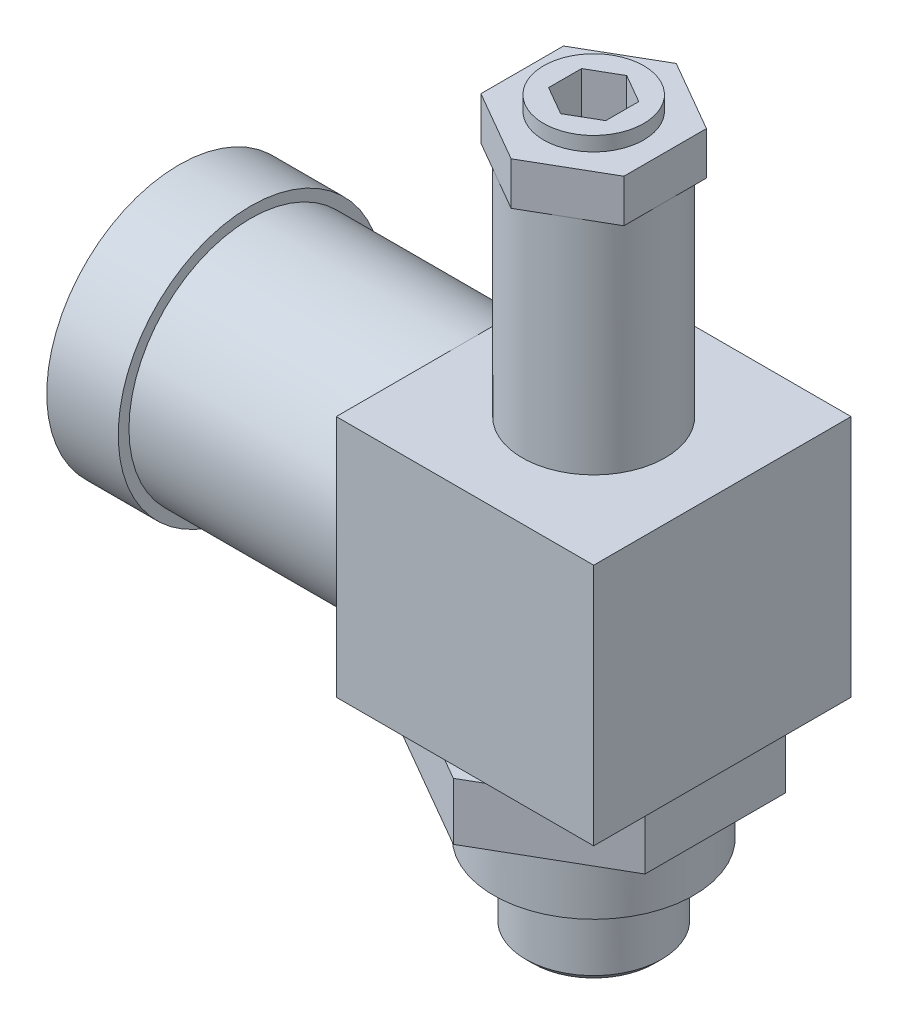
SolidWorks part; units mm, degrees
ref_plane "Plan de face" through (0, 0, 0) normal (0, 0, 1) x (1, 0, 0)
ref_plane "Plan de dessus" through (0, 0, 0) normal (0, 1, 0) x (1, 0, 0)
ref_plane "Plan de droite" through (0, 0, 0) normal (1, 0, 0) x (0, 0, -1)
sketch "Esquisse1" plane through (0, 0, 0) normal (0, 0, 1) x (1, 0, 0)
  line L0 (-9, 0) -> (-24, 0)
  line L1 (-24, 2) -> (-32, 2)
  line L2 (-32, 2) -> (-32, 4.25)
  line L3 (-32, 4.25) -> (-30, 4.25)
  line L4 (-29, 3.5) -> (-29, 9.25)
  line L5 (-29, 9.25) -> (-24, 9.25)
  line L6 (-24, 9.25) -> (-24, 8.5)
  line L7 (-24, 8.5) -> (-9, 8.5)
  line L8 (-9, 8.5) -> (-9, 0)
  line L9 (-9, 0) -> (53.3957, 0) construction
  line L10 (-24, 0) -> (-24, 2)
  line L11 (-30, 4.25) -> (-30, 3.5)
  line L12 (-30, 3.5) -> (-29, 3.5)
  dimension "D1" = 17
  dimension "D2" = 18.5
  dimension "D3" = 15
  dimension "D4" = 5
  dimension "D5" = 8.5
  dimension "D6" = 3
  dimension "D7" = 4
  dimension "D8" = 8
  dimension "D9" = 9
  dimension "D10" = 1
  dimension "D11" = 7
revolve "Révolution1" add sketch "Esquisse1" angle 360 about L9
sketch "Esquisse2" plane through (0, 0, 0) normal (0, 0, 1) x (1, 0, 0)
  line L0 (-9, 8.5) -> (-24, 8.5) construction
  line L1 (-9, 8.5) -> (9, 8.5)
  line L2 (-9, 8.5) -> (-9, -8.5)
  line L3 (-9, -8.5) -> (9, -8.5)
  line L4 (9, 8.5) -> (9, -8.5)
  line L5 (-9, -8.5) -> (-9, 8.5) construction
  line L6 (0, 0) -> (13.8024, 0) construction
  dimension "D1" = 18
extrude "Extrusion1" add sketch "Esquisse2" along normal mid plane 18
sketch "Esquisse3" plane through (0, 0, 0) normal (0, 0, 1) x (1, 0, 0)
  line L0 (0, 0) -> (0, 26.6048) construction
  line L1 (-5, -8.5) -> (-5, 24)
  line L2 (-5, 24) -> (-3.5, 24)
  line L3 (-3.5, 24) -> (-3.5, 28)
  line L4 (-3.5, 28) -> (0, 28)
  line L5 (0, 28) -> (0, -22.5)
  line L6 (0, -22.5) -> (-4.75, -22.5)
  line L7 (-4.75, -22.5) -> (-4.75, -17)
  line L8 (-4.75, -17) -> (-7, -17)
  line L9 (-7, -17) -> (-7, -8.5)
  line L10 (-7, -8.5) -> (-5, -8.5)
  line L12 (-9, -8.5) -> (9, -8.5) construction
  dimension "D1" = 45
  dimension "D2" = 7
  dimension "D3" = 10
  dimension "D4" = 14
  dimension "D5" = 9.5
  dimension "D6" = 8.5
  dimension "D7" = 14
  dimension "D8" = 4
revolve "Révolution2" add sketch "Esquisse3" angle 360 about L0
sketch "Esquisse5" plane through (0, 24, 0) normal (0, 1, 0) x (-1, 0, 0)
  line L1 (5, -2.8868) -> (5, 2.8868)
  line L2 (5, 2.8868) -> (0, 5.7735)
  line L3 (0, 5.7735) -> (-5, 2.8868)
  line L4 (-5, 2.8868) -> (-5, -2.8868)
  line L5 (-5, -2.8868) -> (0, -5.7735)
  line L6 (0, -5.7735) -> (5, -2.8868)
  circle A0 centre (0, 0) radius 5 construction
  dimension "D1" = 10
extrude "Extrusion2" add sketch "Esquisse5" along normal blind 3
sketch "Esquisse4" plane through (0, 28, 0) normal (0, 1, 0) x (-1, 0, 0)
  line L1 (0, 2.3094) -> (-2, 1.1547)
  line L2 (-2, 1.1547) -> (-2, -1.1547)
  line L3 (-2, -1.1547) -> (0, -2.3094)
  line L4 (0, -2.3094) -> (2, -1.1547)
  line L5 (2, -1.1547) -> (2, 1.1547)
  line L6 (2, 1.1547) -> (0, 2.3094)
  circle A0 centre (0, 0) radius 2 construction
  dimension "D1" = 4
extrude "Enlèv. mat.-Extru.1" cut sketch "Esquisse4" against normal blind 5
sketch "Esquisse6" plane through (0, -8.5, 0) normal (0, -1, 0) x (1, 0, 0)
  line L1 (0, 9.815) -> (-8.5, 4.9075)
  line L2 (-8.5, 4.9075) -> (-8.5, -4.9075)
  line L3 (-8.5, -4.9075) -> (0, -9.815)
  line L4 (0, -9.815) -> (8.5, -4.9075)
  line L5 (8.5, -4.9075) -> (8.5, 4.9075)
  line L6 (8.5, 4.9075) -> (0, 9.815)
  circle A0 centre (0, 0) radius 8.5 construction
  dimension "D1" = 17
extrude "Extrusion3" add sketch "Esquisse6" along normal blind 4
chamfer "Chanfrein1" distance 0.5 angle 45 1 edges at (0, -22.5, -4.75)
